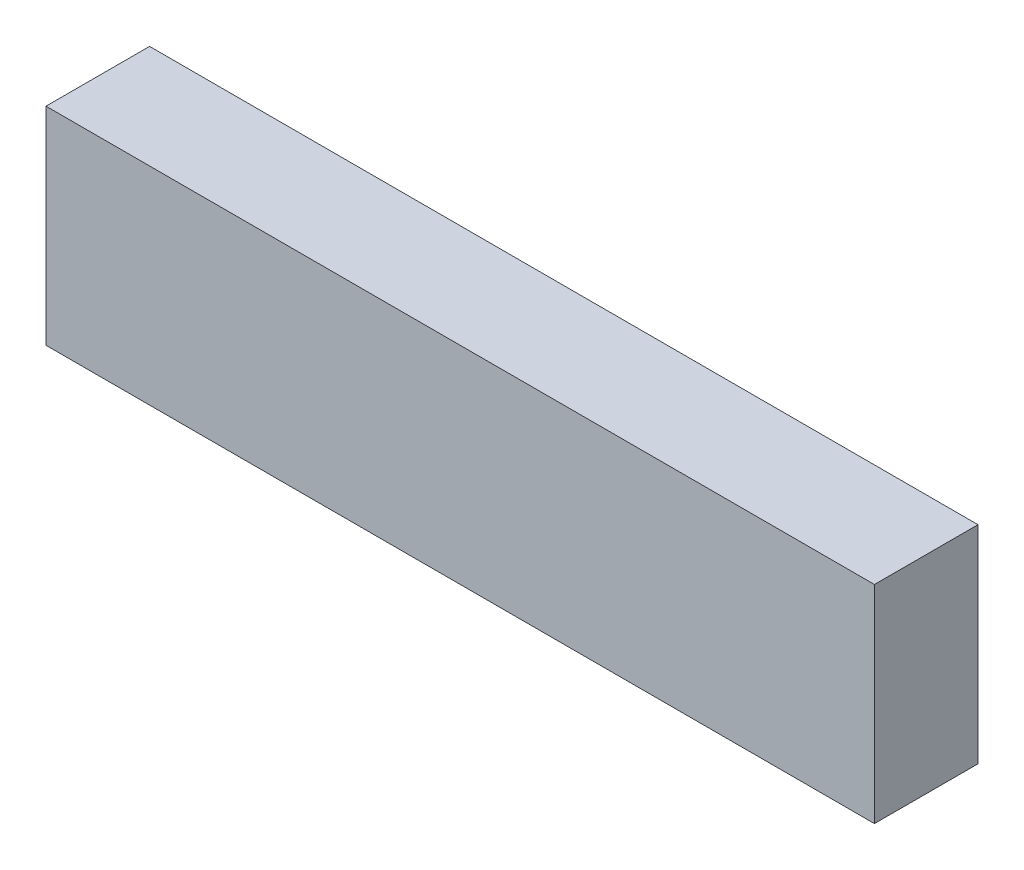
SolidWorks part; units mm, degrees
ref_plane "正面" through (0, 0, 0) normal (0, 0, 1) x (1, 0, 0)
ref_plane "平面" through (0, 0, 0) normal (0, 1, 0) x (1, 0, 0)
ref_plane "右側面" through (0, 0, 0) normal (1, 0, 0) x (0, 0, -1)
sketch "ｽｹｯﾁ1" plane through (0, 0, 0) normal (0, 0, 1) x (1, 0, 0)
  line L1 (-40, -10) -> (40, -10)
  line L2 (-40, -10) -> (-40, 10)
  line L3 (-40, 10) -> (40, 10)
  line L4 (40, -10) -> (40, 10)
  line L5 (-40, -10) -> (40, 10) construction
  line L6 (-40, 10) -> (40, -10) construction
  point P0 (0, 0)
  dimension "D1" = 80
  dimension "D2" = 20
extrude "ﾎﾞｽ - 押し出し1" add sketch "ｽｹｯﾁ1" along normal blind 10
